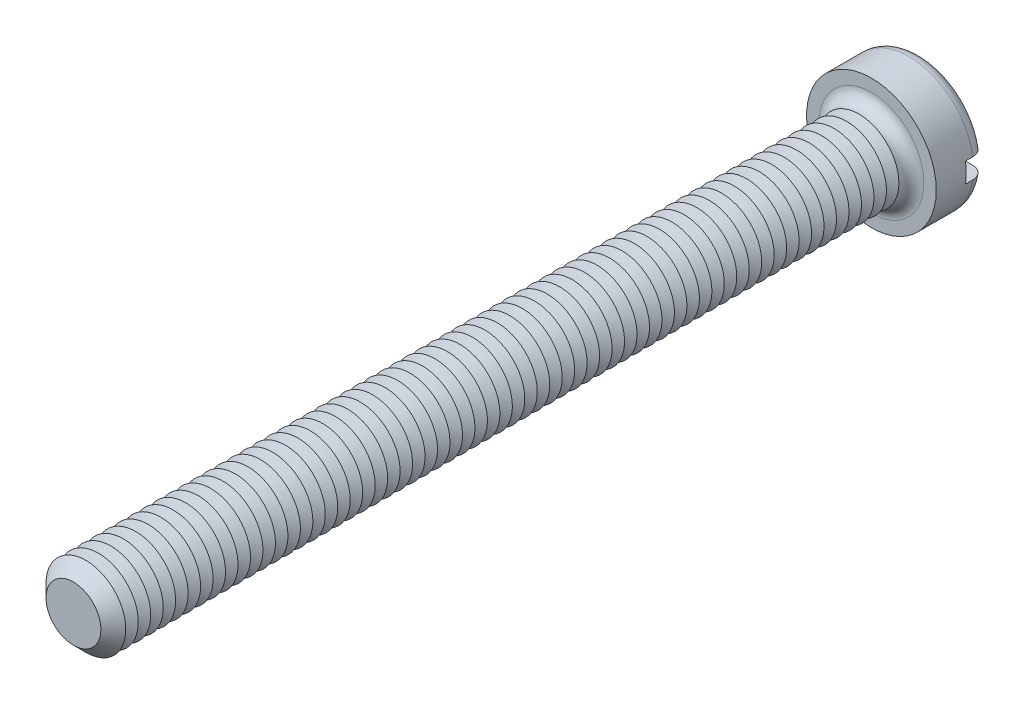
SolidWorks part; units mm, degrees
ref_plane "Front Plane" through (0, 0, 0) normal (0, 0, 1) x (1, 0, 0)
ref_plane "Top Plane" through (0, 0, 0) normal (0, 1, 0) x (1, 0, 0)
ref_plane "Right Plane" through (0, 0, 0) normal (1, 0, 0) x (0, 0, -1)
sketch "Sketch3" plane through (0, 0, 0) normal (0, 0, 1) x (1, 0, 0)
  circle A0 centre (0, 0) radius 6.5
  dimension "D1" = 13
extrude "Boss-Extrude2" add sketch "Sketch3" against normal blind 5
sketch "Sketch4" plane through (0, 0, 0) normal (0, 0, 1) x (1, 0, 0)
  circle A0 centre (0, 0) radius 4
  dimension "D1" = 8
extrude "Boss-Extrude3" add sketch "Sketch4" along normal blind 80
fillet "Fillet1" radius 1.25 2 edges at (6.5, 0, -5) (4, 0, 0)
chamfer "Chamfer1" distance 1.25 angle 45 1 edges at (4, 0, 80)
sketch "Sketch5" plane through (0, 0, 0) normal (1, 0, 0) x (0, 0, -1)
  line L0 (1.6944, 0) -> (-7.6738, 0) construction
sketch "Sketch6" plane through (0, 0, 0) normal (1, 0, 0) x (0, 0, -1)
  line L0 (-1.25, 4) -> (-1.875, 2.9175)
  line L1 (-1.875, 2.9175) -> (-2.5, 4)
  line L2 (-1.25, 4) -> (-78.75, 4) construction
  line L3 (-2.5, 4) -> (-1.25, 4)
  dimension "D1" = 1.25
revolve "Cut-Revolve1" cut sketch "Sketch6" angle 360 about L0
pattern_linear "LPattern1" count 62 spacing 1.25 along (0, 0, 1) of "Cut-Revolve1"
sketch "Sketch8" plane through (0, 0, -5) normal (0, 0, -1) x (-1, 0, 0)
  line L1 (6.5, -1) -> (-6.5, -1)
  line L2 (6.5, -1) -> (6.5, 1)
  line L3 (6.5, 1) -> (-6.5, 1)
  line L4 (-6.5, -1) -> (-6.5, 1)
  line L5 (6.5, -1) -> (-6.5, 1) construction
  line L6 (6.5, 1) -> (-6.5, -1) construction
  point P0 (0, 0)
  dimension "D1" = 13
  dimension "D2" = 2
extrude "Cut-Extrude1" cut sketch "Sketch8" against normal blind 2
